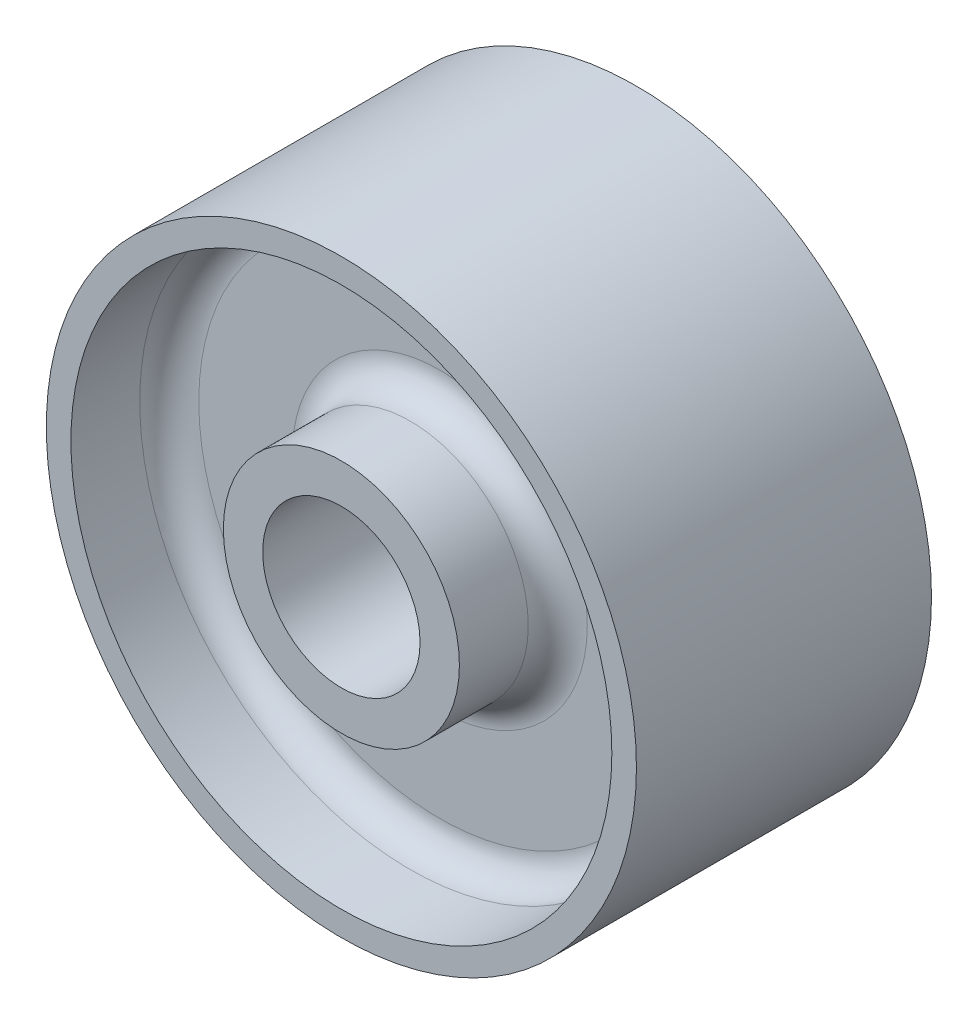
SolidWorks part; units mm, degrees
ref_plane "Front" through (0, 0, 0) normal (0, 0, 1) x (1, 0, 0)
ref_plane "Top" through (0, 0, 0) normal (0, 1, 0) x (1, 0, 0)
ref_plane "Right" through (0, 0, 0) normal (1, 0, 0) x (0, 0, -1)
sketch "Sketch1" plane through (0, 0, 0) normal (0, 0, 1) x (1, 0, 0)
  circle A0 centre (0, 0) radius 60
extrude "Extrude1" add sketch "Sketch1" along normal blind 60
sketch "Sketch2" plane through (0, 0, 0) normal (0, 0, 1) x (1, 0, 0)
  circle A0 centre (0, 0) radius 16
extrude "Cut-Extrude2" cut sketch "Sketch2" along normal through all
sketch "Sketch3" plane through (0, 0, 60) normal (0, 0, 1) x (1, 0, 0)
  circle A0 centre (0, 0) radius 24
  circle A1 centre (0, 0) radius 55
extrude "Cut-Extrude3" cut sketch "Sketch3" against normal blind 20
sketch "Sketch4" plane through (0, 0, 0) normal (0, 0, -1) x (-1, 0, 0)
  circle A0 centre (0, 0) radius 24
  circle A1 centre (0, 0) radius 55
extrude "Cut-Extrude4" cut sketch "Sketch4" against normal blind 20
fillet "Fillet1" radius 6 2 edges at (-24, 0, 20) (-55, 0, 20)
fillet "Fillet2" radius 6 2 edges at (55, 0, 40) (24, 0, 40)
